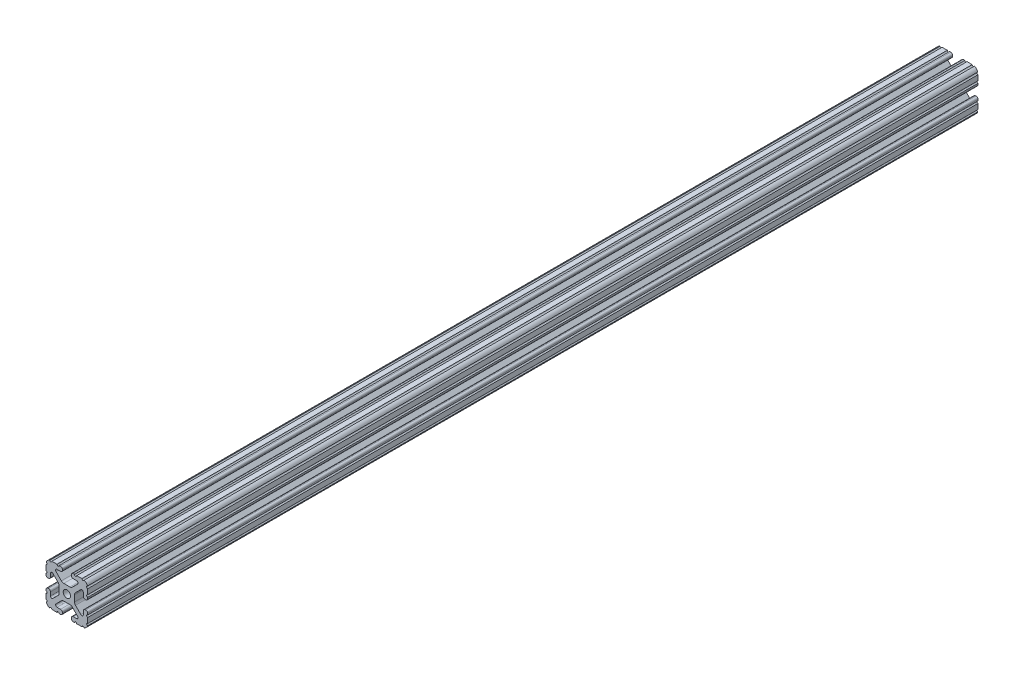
SolidWorks part; units mm, degrees
ref_plane "Front Plane" through (0, 0, 0) normal (0, 0, 1) x (1, 0, 0)
ref_plane "Top Plane" through (0, 0, 0) normal (0, 1, 0) x (1, 0, 0)
ref_plane "Right Plane" through (0, 0, 0) normal (1, 0, 0) x (0, 0, -1)
sketch "Sketch2" plane through (0, 0, 0) normal (0, 0, 1) x (1, 0, 0)
  line L0 (0, 19.05) -> (0, -19.05) construction
  line L1 (-19.05, 0) -> (19.05, 0) construction
  line L2 (4.064, -19.05) -> (19.05, -19.05)
  line L3 (19.05, -19.05) -> (19.05, -4.064)
  line L4 (4.064, -19.05) -> (4.064, -14.986)
  line L5 (4.064, -14.986) -> (12.1123, -14.986)
  line L6 (12.1123, -14.986) -> (4.1113, -6.985)
  line L7 (0, 0) -> (19.05, -19.05) construction
  line L8 (19.05, -4.064) -> (14.986, -4.064)
  line L9 (14.986, -4.064) -> (14.986, -12.1123)
  line L10 (14.986, -12.1123) -> (6.985, -4.1113)
  circle A0 centre (0, 0) radius 3.3274
  arc A1 (8.9963, -14.986) -> (9.909, -12.7826) centre (8.9963, -13.6953) ccw construction
  point P8 (0, -6.985)
sketch "Sketch3" plane through (0, 0, 0) normal (1, 0, 0) x (0, 0, -1)
  line L0 (-457.2, -19.05) -> (457.2, -19.05) construction
  line L1 (-431.8, 0) -> (431.8, 0) construction
sketch "Sketch4" plane through (0, 0, 0) normal (0, 0, 1) x (1, 0, 0)
  line L0 (5.7912, -19.05) -> (14.3002, -19.05)
  line L1 (4.064, -19.05) -> (19.05, -19.05) construction
  line L2 (4.064, -19.05) -> (4.064, -14.986) construction
  line L3 (4.064, -14.986) -> (12.1123, -14.986) construction
  line L4 (4.064, -16.7132) -> (4.064, -17.3228)
  line L5 (5.7912, -14.986) -> (8.9963, -14.986)
  line L6 (0, -6.985) -> (2.833, -6.985)
  line L7 (12.1123, -14.986) -> (4.1113, -6.985) construction
  line L8 (5.0152, -7.8889) -> (9.909, -12.7826)
  line L9 (19.05, -19.05) -> (19.05, -4.064) construction
  line L10 (14.986, -12.1123) -> (6.985, -4.1113) construction
  line L11 (14.986, -4.064) -> (14.986, -12.1123) construction
  line L12 (14.986, -8.9963) -> (14.986, -5.7912)
  line L13 (19.05, -4.064) -> (14.986, -4.064) construction
  line L14 (16.7132, -4.064) -> (17.3228, -4.064)
  line L15 (19.05, -5.7912) -> (19.05, -14.3002)
  line L16 (12.7826, -9.909) -> (7.8889, -5.0152)
  line L17 (6.985, 0) -> (6.985, -2.833)
  line L18 (-19.05, 0) -> (19.05, 0) construction
  line L19 (0, -6.985) -> (0, -3.3274)
  line L20 (0, 19.05) -> (0, -19.05) construction
  line L21 (6.985, 0) -> (3.3274, 0)
  arc A0 (4.064, -17.3228) -> (5.7912, -19.05) centre (5.7912, -17.3228) ccw
  arc A2 (4.064, -16.7132) -> (5.7912, -14.986) centre (5.7912, -16.7132) cw
  arc A3 (8.9963, -14.986) -> (9.909, -12.7826) centre (8.9963, -13.6953) ccw
  arc A4 (2.833, -6.985) -> (5.0152, -7.8889) centre (2.833, -10.0711) cw
  arc A5 (14.3002, -19.05) -> (19.05, -14.3002) centre (14.3002, -14.3002) ccw
  arc A6 (12.7826, -9.909) -> (14.986, -8.9963) centre (13.6953, -8.9963) ccw
  arc A7 (14.986, -5.7912) -> (16.7132, -4.064) centre (16.7132, -5.7912) cw
  arc A8 (17.3228, -4.064) -> (19.05, -5.7912) centre (17.3228, -5.7912) cw
  arc A9 (7.8889, -5.0152) -> (6.985, -2.833) centre (10.0711, -2.833) cw
  circle A10 centre (0, 0) radius 3.3274 construction
  arc A11 (0, -3.3274) -> (3.3274, 0) centre (0, 0) ccw
extrude "Boss-Extrude1" add sketch "Sketch4" along normal mid plane 914.4
sketch "Sketch5" plane through (0, 0, 0) normal (0, 0, 1) x (1, 0, 0)
  line L0 (4.064, -19.05) -> (19.05, -19.05) construction
  line L1 (5.7912, -14.986) -> (8.9963, -14.986) construction
  line L3 (0, 0) -> (19.05, -19.05) construction
  line L4 (8.9963, -14.986) -> (8.9963, -19.05) construction
  line L5 (12.1123, -14.986) -> (4.1113, -6.985) construction
  circle A0 centre (14.7395, -19.05) radius 1.016
  circle A1 centre (7.9803, -19.05) radius 1.016
  circle A2 centre (19.05, -14.7395) radius 1.016
  circle A3 centre (19.05, -7.9803) radius 1.016
  point P10 (7.3938, -14.986)
  point P12 (13.6953, -8.9963)
extrude "Cut-Extrude1" cut sketch "Sketch5" against normal through all both and the other way through all
mirror "Mirror1" about plane through (0, 0, 0) normal (1, 0, 0)
mirror "Mirror2" about plane through (0, 0, 0) normal (0, 1, 0)
sketch "Sketch6" plane through (0, 0, 457.2) normal (0, 0, 1) x (1, 0, 0)
  line L1 (19.5673, -19.4887) -> (-19.5673, -19.4887)
  line L2 (19.5673, -19.4887) -> (19.5673, 19.4887)
  line L3 (19.5673, 19.4887) -> (-19.5673, 19.4887)
  line L4 (-19.5673, -19.4887) -> (-19.5673, 19.4887)
  line L5 (19.5673, -19.4887) -> (-19.5673, 19.4887) construction
  line L6 (19.5673, 19.4887) -> (-19.5673, -19.4887) construction
  point P0 (0, 0)
extrude "Cut-Extrude2" cut sketch "Sketch6" against normal offset from surface (101.6 mm away) 812.8
equation "\"D1@Boss-Extrude1\"=\"Length@Sketch3\""
equation "\"D1@Sketch2\"=\"Thickness@Sketch2\""
equation "\"D2@Sketch4\"=\"Slot Inner Width@Sketch2\"*0.15"
equation "\"D1@Sketch4\"=\"D3@Sketch4\"*2.75"
equation "\"D3@Sketch4\"=\"Thickness@Sketch2\"*0.425"
equation "\"D1@Sketch5\"=\"Thickness@Sketch2\"*0.5"
